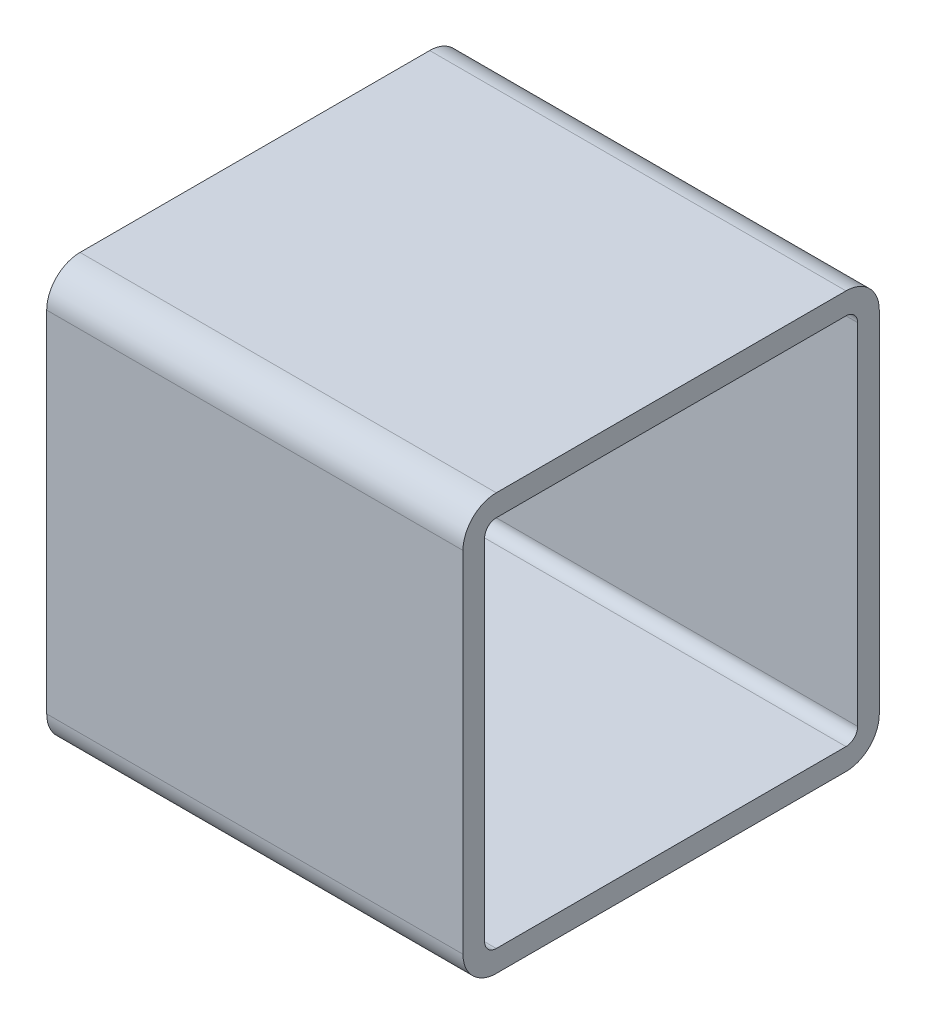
SolidWorks part; units mm, degrees
ref_plane "Front Plane" through (0, 0, 0) normal (0, 0, 1) x (1, 0, 0)
ref_plane "Top Plane" through (0, 0, 0) normal (0, 1, 0) x (1, 0, 0)
ref_plane "Right Plane" through (0, 0, 0) normal (1, 0, 0) x (0, 0, -1)
sketch "Sketch1" plane through (0, 0, 0) normal (1, 0, 0) x (0, 0, -1)
  line L0 (0, 2.54) -> (0, 29.21)
  line L1 (-2.54, 31.75) -> (-29.21, 31.75)
  line L2 (-31.75, 29.21) -> (-31.75, 2.54)
  line L3 (-29.21, 0) -> (-2.54, 0)
  line L4 (-1.651, 2.54) -> (-1.651, 29.21)
  line L5 (-2.54, 30.099) -> (-29.21, 30.099)
  line L6 (-30.099, 29.21) -> (-30.099, 2.54)
  line L7 (-29.21, 1.651) -> (-2.54, 1.651)
  arc A0 (-31.75, 2.54) -> (-29.21, 0) centre (-29.21, 2.54) ccw
  arc A1 (0, 2.54) -> (-2.54, 0) centre (-2.54, 2.54) cw
  arc A2 (0, 29.21) -> (-2.54, 31.75) centre (-2.54, 29.21) ccw
  arc A3 (-31.75, 29.21) -> (-29.21, 31.75) centre (-29.21, 29.21) cw
  arc A4 (-1.651, 29.21) -> (-2.54, 30.099) centre (-2.54, 29.21) ccw
  arc A5 (-30.099, 29.21) -> (-29.21, 30.099) centre (-29.21, 29.21) cw
  arc A6 (-30.099, 2.54) -> (-29.21, 1.651) centre (-29.21, 2.54) ccw
  arc A7 (-1.651, 2.54) -> (-2.54, 1.651) centre (-2.54, 2.54) cw
  point P12 (0, 0)
  point P15 (0, 31.75)
  point P18 (-31.75, 31.75)
  dimension "D3" = 2.54
  dimension "D1" = 31.75
  dimension "D2" = 31.75
  dimension "D4" = 1.651
extrude "Boss-Extrude1" add sketch "Sketch1" along normal blind 31.75
